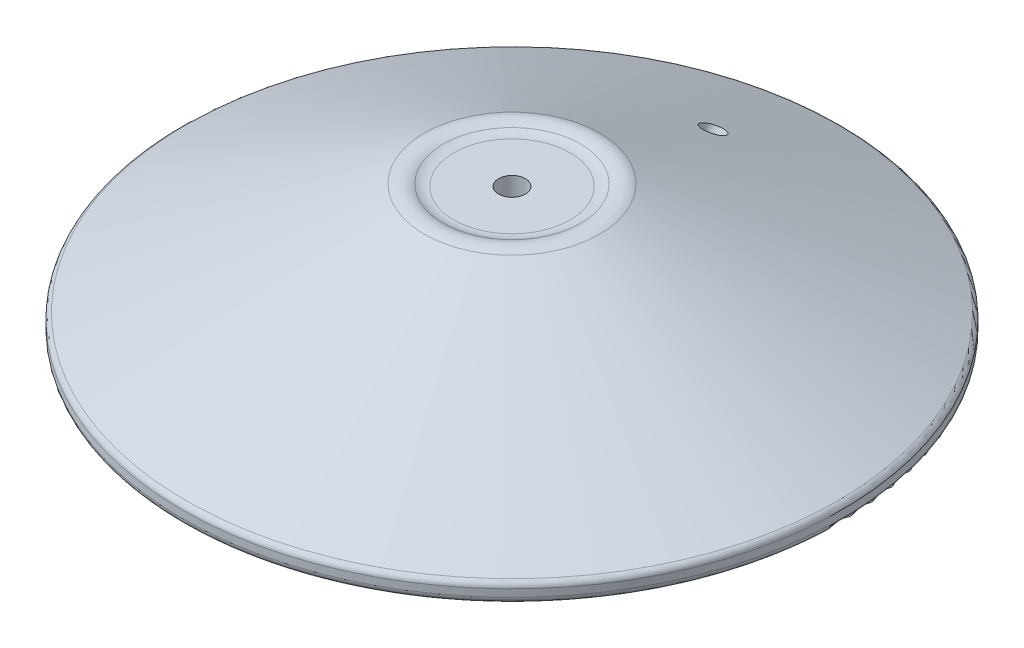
SolidWorks part; units mm, degrees
ref_plane "Plan de face" through (0, 0, 0) normal (0, 0, 1) x (1, 0, 0)
ref_plane "Plan de dessus" through (0, 0, 0) normal (0, 1, 0) x (1, 0, 0)
ref_plane "Plan de coté" through (0, 0, 0) normal (1, 0, 0) x (0, 0, -1)
sketch "Esquisse1" plane through (0, 0, 0) normal (0, 0, 1) x (1, 0, 0)
  line L0 (6, 0) -> (144.5, 0)
  line L1 (147.5, 3) -> (147.5, 6.2848)
  line L2 (145.7758, 9) -> (39.2526, 59.0507)
  line L3 (26.0403, 58) -> (6, 58)
  line L4 (6, 58) -> (6, 0)
  line L5 (0, 0) -> (0, 57.6475) construction
  arc A0 (39.2526, 59.0507) -> (30.7474, 59.0507) centre (35, 50) ccw
  arc A1 (30.7474, 59.0507) -> (26.0403, 58) centre (26.0403, 69.0689) cw
  arc A2 (144.5, 0) -> (147.5, 3) centre (144.5, 3) ccw
  arc A3 (147.5, 6.2848) -> (145.7758, 9) centre (144.5, 6.2848) ccw
  point P16 (6, 56.6553)
  point P17 (0, 0)
  dimension "D4" = 3
  dimension "D5" = 60
  dimension "D7" = 2
  dimension "D8" = 10
  dimension "D1" = 295
  dimension "D2" = 12
  dimension "D3" = 9
  dimension "D6" = 70
revolve "Révolution1" add sketch "Esquisse1" angle 360 about L5
hole_wizard "Diamètre du perçage Ø10.0 (10)1" positions "Esquisse3D1" profile "Esquisse2" hole size "Ø10.0" standard "ISO"
sketch3d "Esquisse3D1"
  point P1 (0, 35.2067, -90)
  point P4 (0, 0, 0)
  dimension "D1" = 90
sketch "Esquisse2" plane through (0, 35.2067, -90) normal (1, 0, 0) x (0, 0.4253, 0.9051)
  line L0 (0, 0) -> (0, 13.0043)
  line L1 (0, 13.0043) -> (5, 10)
  line L2 (5, 10) -> (5, 0)
  line L5 (5, 0) -> (0, 0)
  line L10 (0, 13.0043) -> (-5, 10) construction
  line L11 (0, -6.35) -> (0, 107.95) construction
  dimension "Diamètre du perçage" = 10
  dimension "Profondeur du perçage" = 10
  dimension "Angle de pointe" = 118
chamfer "Chanfrein1" distance 3 angle 45 1 edges at (0, 0, -6)
